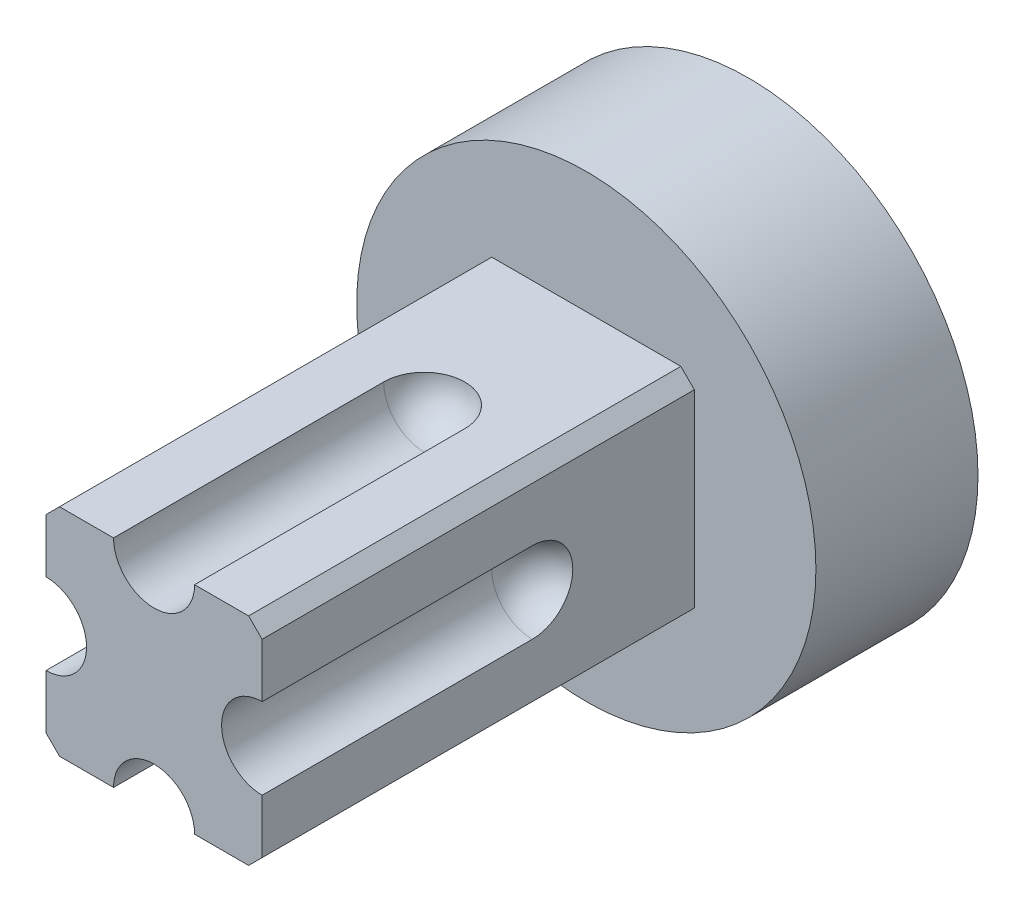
SolidWorks part; units mm, degrees
ref_plane "Front Plane" through (0, 0, 0) normal (0, 0, 1) x (1, 0, 0)
ref_plane "Top Plane" through (0, 0, 0) normal (0, 1, 0) x (1, 0, 0)
ref_plane "Right Plane" through (0, 0, 0) normal (1, 0, 0) x (0, 0, -1)
ref_plane "Plane8" through (0, 82.55, 0) normal (0, 1, 0) x (0, 0, -1)
sketch "Sketch1" plane through (0, 0, 0) normal (0, 0, 1) x (1, 0, 0)
  circle A1 centre (-82.55, 82.55) radius 13.4937
  dimension "D1" = 26.9875
extrude "Extrude1" add sketch "Sketch1" along normal blind 9.525
sketch "Sketch2" plane through (0, 0, 0) normal (0, 0, -1) x (-1, 0, 0)
  circle A0 centre (82.55, 82.55) radius 6.3246
  dimension "D1" = 12.6492
sketch "Sketch4" plane through (0, 0, 9.525) normal (0, 0, 1) x (1, 0, 0)
  line L0 (-76.2, 76.2) -> (-88.9, 88.9) construction
  line L1 (-88.9, 88.9) -> (-76.2, 88.9)
  line L2 (-88.9, 88.9) -> (-88.9, 76.2)
  line L3 (-88.9, 76.2) -> (-76.2, 76.2)
  line L4 (-76.2, 88.9) -> (-76.2, 76.2)
  dimension "D2" = 12.7
extrude "stub" add sketch "Sketch4" along normal blind 25.4
sketch "Sketch5" plane through (0, 0, 9.525) normal (0, 0, 1) x (1, 0, 0)
  line L0 (-73.025, 73.025) -> (-92.075, 92.075) construction
  line L1 (-92.075, 92.075) -> (-73.025, 92.075)
  line L2 (-92.075, 92.075) -> (-92.075, 73.025)
  line L3 (-92.075, 73.025) -> (-73.025, 73.025)
  line L4 (-73.025, 92.075) -> (-73.025, 73.025)
  line L5 (-88.9254, 88.9254) -> (-76.1746, 88.9254)
  line L6 (-76.1746, 88.9254) -> (-76.1746, 76.1746)
  line L7 (-88.9254, 76.1746) -> (-76.1746, 76.1746)
  line L8 (-88.9254, 88.9254) -> (-88.9254, 76.1746)
  dimension "D1" = 19.05
  dimension "D2" = 19.05
  dimension "D3" = 3.1496
sketch "Sketch30" plane through (0, 82.55, 0) normal (0, 1, 0) x (0, 0, -1)
  line L0 (-34.925, 88.9) -> (-9.525, 88.9) construction
  line L1 (-19.05, 86.5187) -> (-53.2154, 86.5187)
  line L2 (-16.6687, 88.9) -> (-53.2154, 88.9)
  line L3 (-53.2154, 88.9) -> (-53.2154, 86.5187)
  line L4 (-53.2154, 88.9) -> (-58.4716, 88.9) construction
  line L5 (-9.525, 96.0437) -> (-9.525, 69.0562) construction
  arc A0 (-19.05, 86.5187) -> (-16.6687, 88.9) centre (-19.05, 88.9) ccw
  dimension "D1" = 9.525
  dimension "D2" = 2.3813
revolve "Cut-Revolve3" cut sketch "Sketch30" angle 360 about L4
ref_plane "Plane1" through (-82.55, 82.55, -42.8625) normal (-1, 0, 0) x (0, -1, 0)
ref_plane "Plane2" through (-82.55, 82.55, -42.8625) normal (-1, 0, 0) x (0, -1, 0)
ref_plane "Plane3" through (-82.55, 82.55, -42.8625) normal (-1, 0, 0) x (0, -1, 0)
ref_plane "Plane4" through (-82.55, 82.55, -42.8625) normal (-1, 0, 0) x (0, -1, 0)
ref_plane "Plane5" through (-82.55, 82.55, -42.8625) normal (-1, 0, 0) x (0, -1, 0)
ref_plane "Plane6" through (-82.55, 82.55, 936.625) normal (-1, 0, 0) x (0, 1, 0)
ref_plane "Plane7" through (-82.55, 82.55, 936.625) normal (-1, 0, 0) x (0, 1, 0)
pattern_circular "CirPattern1" count 4 over 360 about axis through (-82.55, 82.55, 0) along (0, 0, 1) of "Cut-Revolve3"
chamfer "Chamfer2" distance 0.7937 angle 45 4 edges at (-76.2, 76.2, 22.225) (-88.9, 76.2, 22.225) (-88.9, 88.9, 22.225) (-76.2, 88.9, 22.225)
hole_wizard "5/16-18 Tapped Hole1" positions "Sketch32" profile "Sketch31" tap size "5/16-18" standard "ANSI Inch"
sketch "Sketch32" plane through (0, 0, 0) normal (0, 0, -1) x (-1, 0, 0)
  point P0 (82.55, 82.55)
sketch "Sketch31" plane through (-82.55, 82.55, 0) normal (1, 0, 0) x (0, 1, 0)
  line L0 (0, 0) -> (0, 17.8361)
  line L1 (0, 17.8361) -> (3.2639, 15.875)
  line L2 (3.2639, 15.875) -> (3.2639, 0)
  line L5 (3.2639, 0) -> (0, 0)
  line L10 (0, 17.8361) -> (-3.2639, 15.875) construction
  line L11 (0, -6.35) -> (0, 107.95) construction
  dimension "Tap Drill Dia." = 6.5278
  dimension "Tap Drill Depth" = 15.875
  dimension "Drill Angle" = 118
